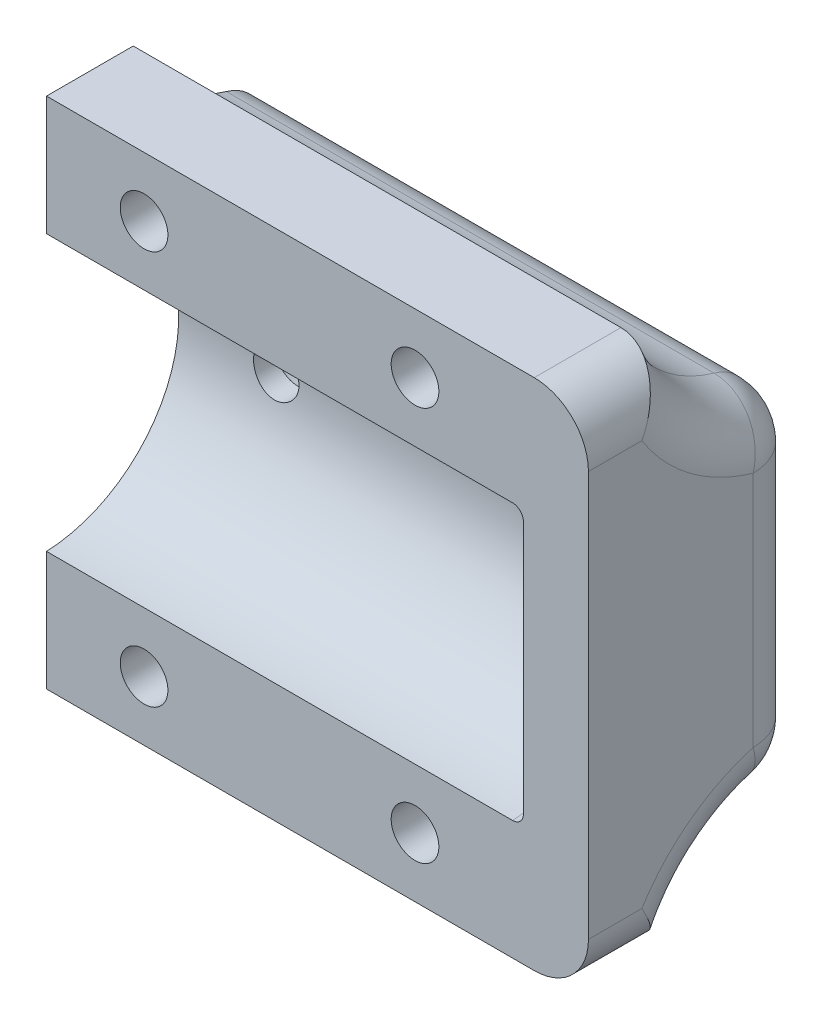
SolidWorks part; units mm, degrees
ref_plane "Front Plane" through (0, 0, 0) normal (1, 0, 0) x (0, 1, 0)
ref_plane "Top Plane" through (0, 0, 0) normal (0, 0, 1) x (0, 1, 0)
ref_plane "Right Plane" through (0, 0, 0) normal (0, 1, 0) x (-1, 0, 0)
sketch "Sketch1" plane through (0, 0, 0) normal (1, 0, 0) x (0, 1, 0)
  line L0 (-12.6902, 0) -> (-23.6902, 0)
  line L1 (-23.6902, 0) -> (-23.6902, -8)
  line L2 (-15.25, -20.2) -> (15.25, -20.2)
  line L3 (12.6902, 0) -> (23.6902, 0)
  line L4 (23.6902, 0) -> (23.6902, -8)
  arc A0 (-12.6902, 0) -> (12.6902, 0) centre (0, 0.5) ccw
  arc A1 (-23.6902, -8) -> (-15.25, -20.2) centre (-28.2875, -20.2) cw
  arc A3 (23.6902, -8) -> (15.25, -20.2) centre (28.2875, -20.2) ccw
  point P8 (0, -20.2)
  dimension "D2" = 12.7
  dimension "D5" = 30.5
  dimension "D1" = 0.5
  dimension "D3" = 11
  dimension "D4" = 8
  dimension "D6" = 20.2
extrude "Boss-Extrude1" add sketch "Sketch1" along normal blind 50
sketch "Sketch2" plane through (50, 0, 0) normal (1, 0, 0) x (0, 1, 0)
  line L0 (-12.6902, 0) -> (12.6902, 0)
  arc A2 (-12.6902, 0) -> (12.6902, 0) centre (0, 0.5) ccw
  arc A3 (-12.6902, 0) -> (12.6902, 0) centre (0, 0.5) ccw
  dimension "D1" = 0
extrude "Boss-Extrude2" add sketch "Sketch2" against normal blind 6
fillet "Fillet1" radius 1 1 edges at (44, 0, -12.2)
sketch "Sketch3" plane through (0, 0, 0) normal (0, 0, 1) x (1, 0, 0)
  line L0 (9, 18.1902) -> (34, 18.1902) construction
  line L2 (34, 18.1902) -> (34, -18.1902) construction
  line L4 (0, 23.6902) -> (0, 12.6902) construction
  line L5 (43, 12.6902) -> (0, 12.6902) construction
  line L6 (0, -12.6902) -> (0, -23.6902) construction
  circle A4 centre (9, 18.1902) radius 2.1
  circle A5 centre (34, 18.1902) radius 2.1
  circle A6 centre (9, -18.1902) radius 2.1
  circle A7 centre (34, -18.1902) radius 2.1
  point P10 (0, 18.1902)
  point P13 (21.5, 12.6902)
  point P14 (21.5, 18.1902)
  point P18 (0, -18.1902)
  dimension "D1" = 4.2
  dimension "D2" = 25
extrude "Cut-Extrude1" cut sketch "Sketch3" against normal through all
fillet "Fillet2" radius 5 7 edges at (50, 17.5657, -12.7825) (50, 0, -20.2) (50, -17.5657, -12.7825) (25, 15.25, -20.2) (25, -15.25, -20.2) (50, -23.6902, -4) (50, 23.6902, -4)
sketch "Sketch4" plane through (0, 0, -20.2) normal (0, 0, -1) x (1, 0, 0)
  line L0 (9, 18.1902) -> (9, -18.1902) construction
  line L1 (34, 18.1902) -> (34, -18.1902) construction
  circle A0 centre (9, 0) radius 6
  circle A1 centre (34, 0) radius 6
  point P12 (9, 0)
  point P13 (34, 0)
  dimension "D1" = 12
extrude "Cut-Extrude2" cut sketch "Sketch4" against normal blind 6
sketch "Sketch5" plane through (0, 0, -14.2) normal (0, 0, -1) x (1, 0, 0)
  circle A0 centre (9, 0) radius 2.1
  circle A1 centre (34, 0) radius 2.1
  dimension "D1" = 4.2
extrude "Cut-Extrude3" cut sketch "Sketch5" against normal through all
sketch "Sketch7" plane through (0, 0, 0) normal (0, 0, 1) x (1, 0, 0)
  circle A0 centre (9, -18.1902) radius 2.2
  circle A1 centre (34, -18.1902) radius 2.2
  circle A2 centre (9, 18.1902) radius 2.2
  circle A3 centre (34, 18.1902) radius 2.2
  dimension "D1" = 4.4
extrude "Cut-Extrude4" cut sketch "Sketch7" against normal blind 5
fillet "Fillet3" radius 1 2 edges at (3, 0, -14.2) (28, 0, -14.2)
sketch "Sketch8" plane through (0, 0, -20.2) normal (0, 0, -1) x (1, 0, 0)
  line L0 (9, 0) -> (34, 0) construction
  circle A0 centre (21.5, 0) radius 2.2
  dimension "D1" = 4.4
extrude "Cut-Extrude5" cut sketch "Sketch8" against normal blind 5
